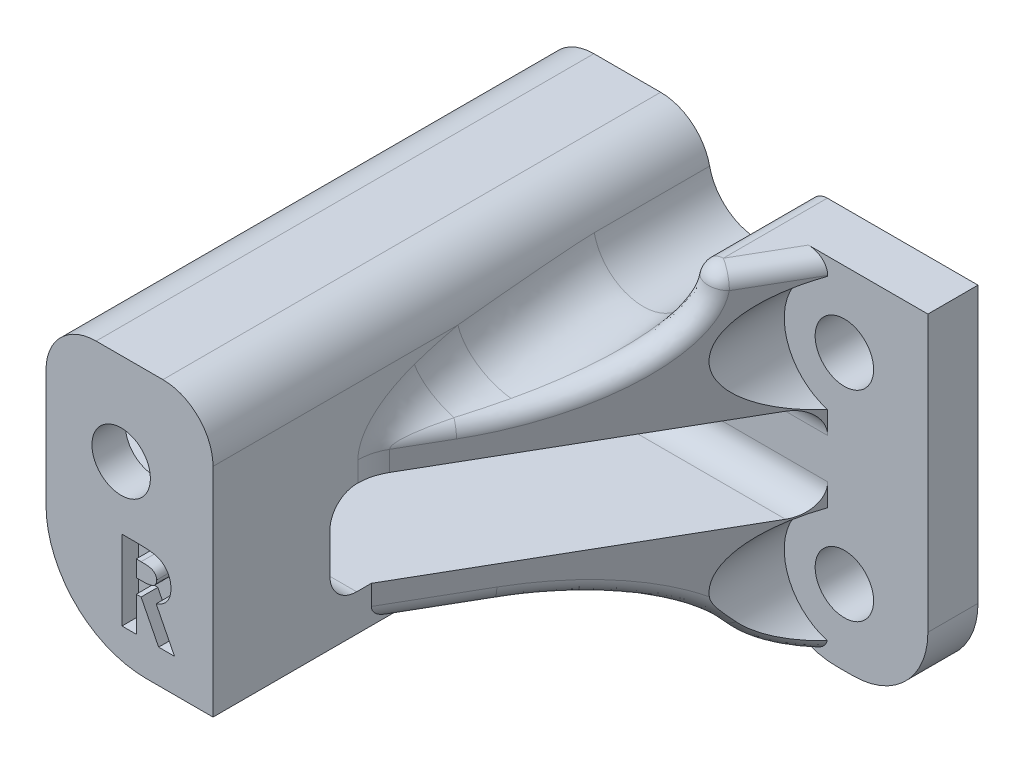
SolidWorks part; units mm, degrees
ref_plane "Front Plane" through (0, 0, 0) normal (0, 0, 1) x (1, 0, 0)
ref_plane "Top Plane" through (0, 0, 0) normal (0, 1, 0) x (1, 0, 0)
ref_plane "Right Plane" through (0, 0, 0) normal (1, 0, 0) x (0, 0, -1)
sketch "Sketch1" plane through (0, 0, 0) normal (0, 0, 1) x (1, 0, 0)
  line L1 (-5.5983, 15.5867) -> (4.4017, 15.5867)
  line L2 (-5.5983, 15.5867) -> (-5.5983, -5.4133)
  line L3 (-5.5983, -5.4133) -> (4.4017, -5.4133)
  line L4 (4.4017, 15.5867) -> (4.4017, -5.4133)
  circle A0 centre (-0.5983, 11.0867) radius 1.75
  circle A1 centre (-0.5983, -0.9133) radius 1.75
  point P8 (-0.5983, -5.4133)
  dimension "D3" = 3.5
  dimension "D4" = 3.5
  dimension "D1" = 10
  dimension "D2" = 4.5
  dimension "D5" = 5
  dimension "D6" = 5
  dimension "D7" = 12
  dimension "D8" = 4.5
extrude "Boss-Extrude1" add sketch "Sketch1" along normal blind 3
ref_plane "Plane1" through (0, 0, 3) normal (0, 0, 1) x (1, 0, 0)
sketch "Sketch2" plane through (0, 0, 3) normal (0, 0, 1) x (1, 0, 0)
  line L1 (-21.5983, 16.0867) -> (-11.5983, 16.0867)
  line L2 (-21.5983, 16.0867) -> (-21.5983, 0.0867)
  line L3 (-21.5983, 0.0867) -> (4.4017, 0.0867)
  line L4 (4.4017, 10.0867) -> (4.4017, 0.0867)
  line L5 (4.4017, 15.5867) -> (-5.5983, 15.5867) construction
  line L7 (4.4017, -5.4133) -> (4.4017, 15.5867) construction
  line L8 (-11.5983, 16.0867) -> (-11.5983, 10.0867)
  line L9 (-11.5983, 10.0867) -> (4.4017, 10.0867)
  dimension "D1" = 10
  dimension "D2" = 5.5
  dimension "D3" = 26
  dimension "D4" = 10
  dimension "D5" = 6
extrude "Extrude-Thin1" add sketch "Sketch2" along normal blind 26.8 thin
ref_plane "Plane2" through (0, 0, 29.8) normal (0, 0, 1) x (1, 0, 0)
sketch "Sketch10" plane through (0, 0, 29.8) normal (0, 0, 1) x (1, 0, 0)
  line L0 (-21.5983, 0.0867) -> (4.4017, 0.0867) construction
  line L1 (-21.5983, 16.0867) -> (-11.5983, 16.0867)
  line L2 (-21.5983, 16.0867) -> (-21.5983, 0.0867)
  line L3 (-21.5983, 0.0867) -> (4.4017, 0.0867)
  line L4 (4.4017, 10.0867) -> (4.4017, 0.0867)
  line L5 (4.4017, 0.0867) -> (4.4017, 10.0867) construction
  line L6 (-11.5983, 16.0867) -> (-11.5983, 10.0867)
  line L7 (-11.5983, 10.0867) -> (4.4017, 10.0867)
  line L8 (4.4017, 10.0867) -> (-11.5983, 10.0867) construction
  line L9 (4.4017, 10.0867) -> (4.4017, 15.5867) construction
extrude "Boss-Extrude4" add sketch "Sketch10" against normal blind 7
ref_plane "Plane4" through (0, 0, 27.8) normal (0, 0, 1) x (1, 0, 0)
sketch "Sketch8" plane through (0, 0, 29.8) normal (0, 0, 1) x (1, 0, 0)
  circle A1 centre (-0.5983, 11.0867) radius 3.5
  circle A2 centre (-0.5983, -0.9133) radius 3.5
  dimension "D3" = 7
  dimension "D4" = 7
extrude "Cut-Extrude3" cut sketch "Sketch8" against normal up to surface (26.8 mm away)
sketch "Sketch13" plane through (0, 0, 29.8) normal (0, 0, 1) x (1, 0, 0)
  line L0 (-21.5983, 16.0867) -> (-21.5983, 0.0867) construction
  line L2 (-21.5983, 0.0867) -> (-3.9524, 0.0867) construction
  circle A0 centre (-17.0983, 10.5867) radius 1.75
  dimension "D1" = 3.5
  dimension "D2" = 4.5
  dimension "D3" = 10.5
extrude "Cut-Extrude6" cut sketch "Sketch13" against normal blind 17.8
sketch "Sketch14" plane through (0, 0, 3) normal (0, 0, 1) x (1, 0, 0)
  line L0 (-5.5983, 0.0867) -> (-5.5983, 10.0867)
  line L1 (-5.5983, 10.0867) -> (-11.5983, 10.0867)
  line L2 (-11.5983, 10.0867) -> (-11.5983, 16.0867)
  line L3 (-11.5983, 16.0867) -> (-21.5983, 16.0867)
  line L4 (-21.5983, 16.0867) -> (-21.5983, 0.0867)
  line L5 (-21.5983, 0.0867) -> (-5.5983, 0.0867)
extrude "Boss-Extrude5" add sketch "Sketch14" against normal up to surface (3 mm away)
sketch "Sketch12" plane through (0, 0, 27.8) normal (0, 0, 1) x (1, 0, 0)
  line L1 (-21.5983, 13.4367) -> (-13.5983, 13.4367)
  line L2 (-21.5983, 13.4367) -> (-21.5983, 7.7367)
  line L3 (-21.5983, 7.7367) -> (-13.5983, 7.7367)
  line L4 (-13.5983, 13.4367) -> (-13.5983, 7.7367)
  line L8 (-21.5983, 16.0867) -> (-21.5983, 0.0867) construction
  line L9 (-11.5983, 10.0867) -> (-11.5983, 16.0867) construction
  line L10 (-11.5983, 16.0867) -> (-21.5983, 16.0867) construction
  dimension "D2" = 2.65
  dimension "D1" = 5.7
  dimension "D4" = 2
extrude "Cut-Extrude5" cut sketch "Sketch12" against normal blind 2.8
fillet "Fillet5" radius 4.5 2 edges at (4.4017, -5.4133, 1.5) (-5.5983, -5.4133, 1.5)
ref_plane "Plane5" through (0, 0, 29.8) normal (0, 0, 1) x (1, 0, 0)
sketch "Sketch15" plane through (0, 0, 29.8) normal (0, 0, 1) x (1, 0, 0)
  line L1 (4.4017, 0.0867) -> (-11.5983, 0.0867)
  line L2 (4.4017, 0.0867) -> (4.4017, 10.0867)
  line L3 (4.4017, 10.0867) -> (-11.5983, 10.0867)
  line L4 (-11.5983, 0.0867) -> (-11.5983, 10.0867)
extrude "Cut-Extrude7" cut sketch "Sketch15" against normal up to surface (26.8 mm away)
fillet "Fillet6" radius 5 2 edges at (-5.5983, 10.0867, 1.5) (-5.5983, 0.0867, 1.5)
chamfer "Chamfer1" distance 10 angle 60 2 edges at (-11.5983, 8.9867, 3) (-11.5983, 1.1867, 3)
fillet "Fillet7" radius 1.6 11 edges at (-7.6983, 7.8867, 3) (-10.4983, 2.2867, 3) (-19.3983, 13.8867, 12.9) (-19.3983, 8.0867, 22.8) (-19.3983, 2.2867, 12.9) (-13.7983, 10.8867, 3) (-13.7983, 13.8867, 12.9) (-16.5983, 13.8867, 3) (-19.3983, 8.0867, 3) (-12.6983, 7.8867, 22.8) (-15.4983, 2.2867, 22.8)
fillet "Fillet8" radius 3 2 edges at (-11.5983, 16.0867, 14.9) (-21.5983, 16.0867, 14.9)
fillet "Fillet9" radius 6 1 edges at (-21.5983, 0.0867, 14.9)
fillet "Fillet10" radius 1 6 edges at (-7.0628, 11.5512, 12.4647) (-5.5983, 15.3367, 9.9282) (-10.6567, 0.0867, 18.6896) (-7.025, -0.6986, 12.3993) (-3.7267, -4.5659, 6.6866) (-11.0983, 10.0867, 19.4545)
sketch "Sketch16" plane through (0, 0, 3) normal (0, 0, 1) x (1, 0, 0)
  circle A0 centre (-0.5983, 11.0867) radius 3.6
  circle A1 centre (-0.5983, -0.9133) radius 3.6
  dimension "D1" = 7.2
  dimension "D2" = 7.2
extrude "Cut-Extrude8" cut sketch "Sketch16" along normal blind 8
ref_plane "Plane6" through (0, 0, 29.8) normal (0, 0, 1) x (1, 0, 0)
sketch "Sketch17" plane through (0, 0, 29.8) normal (0, 0, 1) x (1, 0, 0)
  line L0 (-17.5983, 2.0867) -> (-13.5983, 2.0867) construction
  line L1 (-14.5983, 16.0867) -> (-18.5983, 16.0867) construction
  line L2 (-11.5983, 0.0867) -> (-11.5983, 13.0867) construction
  text T0 "R" font "Century Gothic" height in points 18
  point P5 (-16.5983, 16.0867)
  dimension "D1" = 14
  dimension "D2" = 4
  dimension "D3" = 2
extrude "Cut-Extrude9" cut sketch "Sketch17" against normal blind 1
fillet "Fillet11" radius 3 3 edges at (-11.5983, 8.4867, 20.3205) (-11.5983, 9.7938, 19.7347) (-11.5983, 10.0867, 9.1603)
fillet "Fillet12" radius 1 3 edges at (-2.6653, 15.5867, 4.8481) (-4.8571, 15.5867, 7.1621) (-5.5983, 15.5867, 3.0981)
